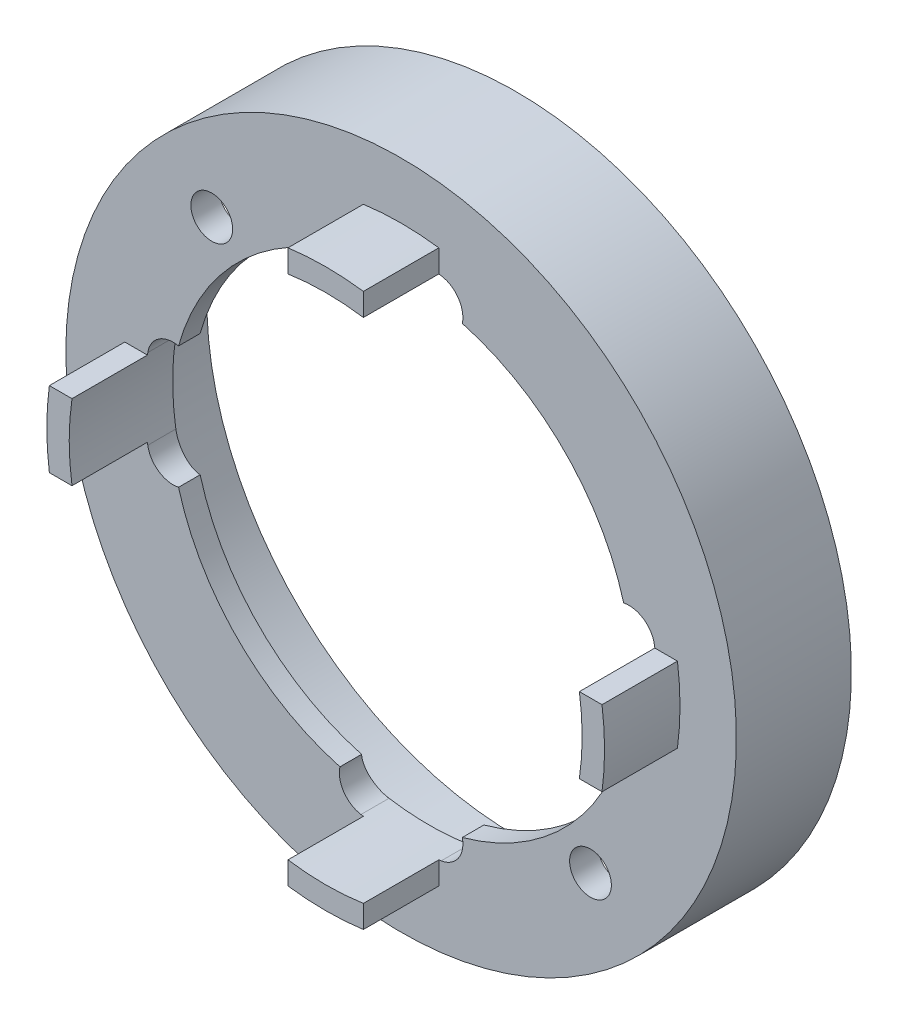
SolidWorks part; units mm, degrees
ref_plane "Front Plane" through (0, 0, 0) normal (0, 0, 1) x (1, 0, 0)
ref_plane "Top Plane" through (0, 0, 0) normal (0, 1, 0) x (1, 0, 0)
ref_plane "Right Plane" through (0, 0, 0) normal (1, 0, 0) x (0, 0, -1)
ref_plane "Plane1" through (0, 0, 1.8) normal (0, 0, 1) x (1, 0, 0)
ref_plane "Plane2" through (0, 0, 3.24) normal (0, 0, 1) x (1, 0, 0)
sketch "Sketch1" plane through (0, 0, 0) normal (0, 0, 1) x (1, 0, 0)
  circle A0 centre (0, 0) radius 22.225
  dimension "D1" = 44.45
extrude "Boss-Extrude1" add sketch "Sketch1" along normal blind 7.62
sketch "Sketch2" plane through (0, 0, 7.62) normal (0, 0, 1) x (1, 0, 0)
  circle A0 centre (0, 0) radius 15.3
  dimension "D1" = 30.6
extrude "Cut-Extrude1" cut sketch "Sketch2" against normal up to next
sketch "Sketch3" plane through (0, 0, 0) normal (0, 1, 0) x (1, 0, 0)
  line L0 (0, 1.4244) -> (0, 7.804) construction
  line L1 (-22.225, -7.62) -> (22.225, -7.62) construction
  line L2 (-17, -5.7613) -> (-20.5, -5.7613)
  line L3 (0, -6.2629) -> (-15, -6.2629) construction
  line L4 (-15, 0) -> (-15, -6.2629)
  line L5 (-17, -5.7613) -> (-15, -6.2629)
  line L6 (-20.5, -5.7613) -> (-20.5, 0)
  line L7 (22.225, 0) -> (-22.225, 0) construction
  line L8 (-20.5, 0) -> (-15, 0)
  point P9 (-16, -6.0121)
  dimension "D1" = 15
  dimension "D2" = 1.6079
  dimension "D3" = 75.92
  dimension "D4" = 16
  dimension "D5" = 20.5
  dimension "D8" = 17
revolve "Cut-Revolve1" cut sketch "Sketch3" angle 360 about L0
sketch "Sketch4" plane through (0, 0, 7.62) normal (0, 0, 1) x (1, 0, 0)
  line L0 (0, 0) -> (0, 50000) construction
  line L1 (0, 0) -> (-50000, 0) construction
  line L2 (-16.8152, 2.5) -> (-18.3152, 2.5)
  line L4 (-18.3152, -2.5) -> (-16.8152, -2.5)
  arc A0 (-16.8152, 2.5) -> (-16.8152, -2.5) centre (0, 0) ccw
  arc A2 (-18.3152, 2.5) -> (-18.3152, -2.5) centre (0, 0) ccw
  dimension "D1" = 5
  dimension "D3" = 17
  dimension "D2" = 1.5
extrude "Boss-Extrude2" add sketch "Sketch4" along normal blind 5
sketch "Sketch5" plane through (0, 0, 7.62) normal (0, 0, 1) x (1, 0, 0)
  line L0 (-15.1116, 2.3934) -> (0, 0) construction
  line L1 (0, 0) -> (-15.1116, -2.3934) construction
  line L2 (0, 0) -> (-15.3, 0) construction
  arc A0 (-15.1116, -2.3934) -> (-15.1116, 2.3934) centre (0, 0) cw construction
  circle A1 centre (0, 0) radius 15.3 construction
  arc A3 (-16.7907, 2.6594) -> (-16.7907, -2.6594) centre (0, 0) ccw
  arc A4 (-13.4326, 2.1275) -> (-13.4326, -2.1275) centre (0, 0) ccw
  arc A5 (-13.4326, 2.1275) -> (-16.7907, 2.6594) centre (-15.1116, 2.3934) ccw
  arc A6 (-16.7907, -2.6594) -> (-13.4326, -2.1275) centre (-15.1116, -2.3934) ccw
  arc A7 (-16.8152, 2.5) -> (-16.8152, -2.5) centre (0, 0) ccw construction
  point P5 (-15.3, 0)
  dimension "D1" = 18
extrude "Cut-Extrude2" cut sketch "Sketch5" against normal up to next
pattern_circular "CirPattern1" count 4 every 90 about axis through (0, 0, 0) along (0, 0, 1) of "Boss-Extrude2", "Cut-Extrude2"
sketch "Sketch6" plane through (0, 0, 5.7613) normal (0, 0, -1) x (-1, 0, 0)
  line L0 (12.5511, 12.5511) -> (-12.5511, -12.5511) construction
  line L1 (0, 0) -> (10.612, 0) construction
  circle A0 centre (-12.5511, -12.5511) radius 1.3843
  circle A1 centre (12.5511, 12.5511) radius 1.3843
  dimension "D1" = 45
  dimension "D3" = 2.7686
  dimension "D2" = 35.5
extrude "Cut-Extrude3" cut sketch "Sketch6" against normal blind 3
